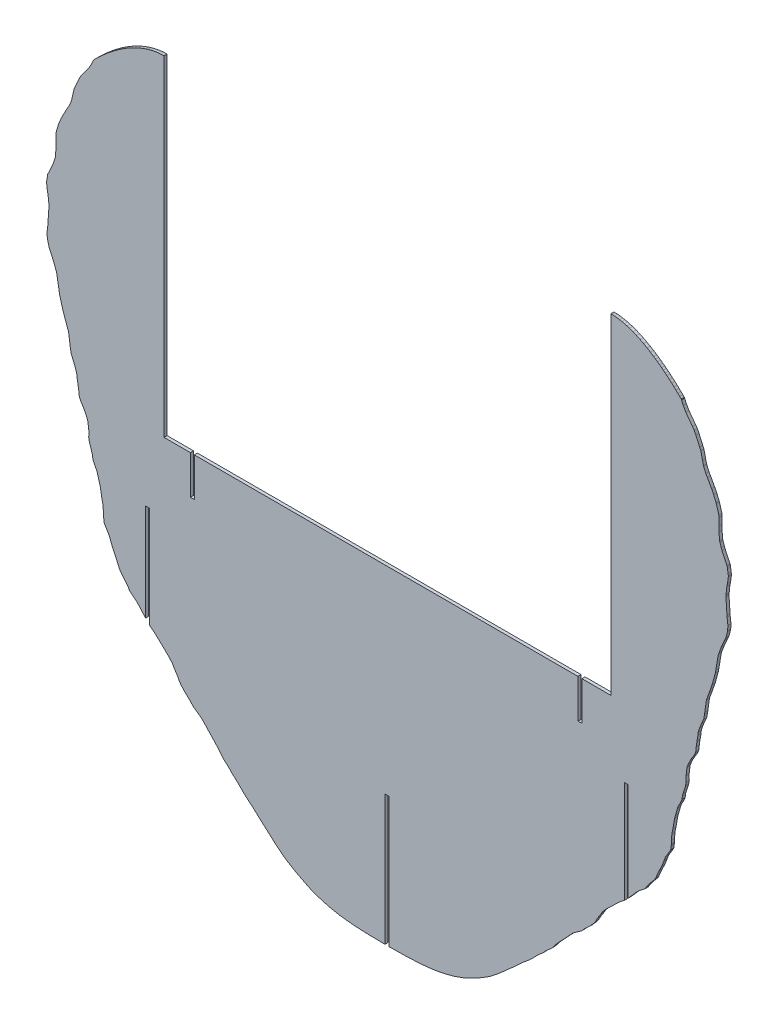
SolidWorks part; units mm, degrees
ref_plane "Спереди" through (0, 0, 0) normal (0, 0, 1) x (1, 0, 0)
ref_plane "Сверху" through (0, 0, 0) normal (0, 1, 0) x (1, 0, 0)
ref_plane "Справа" through (0, 0, 0) normal (1, 0, 0) x (0, 0, -1)
sketch "Model" plane through (0, 0, 0) normal (0, 0, 1) x (1, 0, 0)
  line L0 (-7682.8067, 1816.6971) -> (-7684.8067, 1816.6971)
  line L1 (-7684.8067, 1816.6971) -> (-7685.0567, 1816.6971)
  line L2 (-7685.0567, 1816.6971) -> (-7685.0567, 1732.4192)
  line L3 (-7685.0567, 1732.4192) -> (-7694.5872, 1732.5452)
  line L4 (-7694.5872, 1732.5452) -> (-7695.922, 1732.563)
  line L5 (-7695.922, 1732.563) -> (-7696.6975, 1732.6032)
  line L6 (-7696.6975, 1732.6032) -> (-7698.3765, 1732.6876)
  line L7 (-7698.3765, 1732.6876) -> (-7705.6061, 1733.0389)
  line L8 (-7705.6061, 1733.0389) -> (-7709.5556, 1733.4832)
  line L9 (-7709.5556, 1733.4832) -> (-7714.152, 1734.023)
  line L10 (-7714.152, 1734.023) -> (-7718.3061, 1734.8094)
  line L11 (-7718.3061, 1734.8094) -> (-7721.3007, 1735.4051)
  line L12 (-7721.3007, 1735.4051) -> (-7723.5175, 1736.0273)
  line L13 (-7723.5175, 1736.0273) -> (-7726.4439, 1736.831)
  line L14 (-7726.4439, 1736.831) -> (-7730.4207, 1738.2057)
  line L15 (-7730.4207, 1738.2057) -> (-7733.3113, 1739.2805)
  line L16 (-7733.3113, 1739.2805) -> (-7735.5196, 1740.3507)
  line L17 (-7735.5196, 1740.3507) -> (-7743.1818, 1744.2907)
  line L18 (-7743.1818, 1744.2907) -> (-7743.234, 1744.3141)
  line L19 (-7743.234, 1744.3141) -> (-7743.2862, 1744.3375)
  line L20 (-7743.2862, 1744.3375) -> (-7743.8617, 1744.6887)
  line L21 (-7743.8617, 1744.6887) -> (-7743.9294, 1744.7294)
  line L22 (-7743.9294, 1744.7294) -> (-7743.997, 1744.7701)
  line L23 (-7743.997, 1744.7701) -> (-7746.4079, 1746.2427)
  line L24 (-7746.4079, 1746.2427) -> (-7746.9716, 1746.5727)
  line L25 (-7746.9716, 1746.5727) -> (-7747.2628, 1746.7644)
  line L26 (-7747.2628, 1746.7644) -> (-7748.5724, 1747.5636)
  line L27 (-7748.5724, 1747.5636) -> (-7750.2895, 1748.7556)
  line L28 (-7750.2895, 1748.7556) -> (-7750.4549, 1748.8644)
  line L29 (-7750.4549, 1748.8644) -> (-7750.6203, 1748.9732)
  line L30 (-7750.6203, 1748.9732) -> (-7750.7251, 1749.0581)
  line L31 (-7750.7251, 1749.0581) -> (-7750.9248, 1749.1966)
  line L32 (-7750.9248, 1749.1966) -> (-7752.0277, 1750.1115)
  line L33 (-7752.0277, 1750.1115) -> (-7754.1352, 1751.8159)
  line L34 (-7754.1352, 1751.8159) -> (-7756.559, 1753.7467)
  line L35 (-7756.559, 1753.7467) -> (-7757.454, 1754.6197)
  line L36 (-7757.454, 1754.6197) -> (-7758.2773, 1755.2931)
  line L37 (-7758.2773, 1755.2931) -> (-7759.5082, 1756.4509)
  line L38 (-7759.5082, 1756.4509) -> (-7764.286, 1760.6263)
  line L39 (-7764.286, 1760.6263) -> (-7767.697, 1763.7832)
  line L40 (-7767.697, 1763.7832) -> (-7769.7344, 1765.6174)
  line L41 (-7769.7344, 1765.6174) -> (-7770.6738, 1766.5109)
  line L42 (-7770.6738, 1766.5109) -> (-7770.8443, 1766.6855)
  line L43 (-7770.8443, 1766.6855) -> (-7771.2598, 1767.0364)
  line L44 (-7771.2598, 1767.0364) -> (-7771.6414, 1767.3061)
  line L45 (-7771.6414, 1767.3061) -> (-7772.7886, 1768.2678)
  line L46 (-7772.7886, 1768.2678) -> (-7774.9976, 1770.1285)
  line L47 (-7774.9976, 1770.1285) -> (-7777.4658, 1772.4707)
  line L48 (-7777.4658, 1772.4707) -> (-7780.2333, 1775.2889)
  line L49 (-7780.2333, 1775.2889) -> (-7782.2505, 1777.1364)
  line L50 (-7782.2505, 1777.1364) -> (-7784.5093, 1779.1408)
  line L51 (-7784.5093, 1779.1408) -> (-7785.5694, 1780.417)
  line L52 (-7785.5694, 1780.417) -> (-7786.5279, 1781.2931)
  line L53 (-7786.5279, 1781.2931) -> (-7790.0308, 1784.4159)
  line L54 (-7790.0308, 1784.4159) -> (-7792.7157, 1787.8803)
  line L55 (-7792.7157, 1787.8803) -> (-7793.3302, 1788.6343)
  line L56 (-7793.3302, 1788.6343) -> (-7802.8222, 1798.7827)
  line L57 (-7802.8222, 1798.7827) -> (-7803.1732, 1799.1838)
  line L58 (-7803.1732, 1799.1838) -> (-7803.3726, 1799.3677)
  line L59 (-7803.3726, 1799.3677) -> (-7803.4627, 1799.4482)
  line L60 (-7803.4627, 1799.4482) -> (-7803.5528, 1799.5288)
  line L61 (-7803.5528, 1799.5288) -> (-7805.7115, 1801.1681)
  line L62 (-7805.7115, 1801.1681) -> (-7809.1877, 1803.6167)
  line L63 (-7809.1877, 1803.6167) -> (-7811.2248, 1805.8476)
  line L64 (-7811.2248, 1805.8476) -> (-7812.4073, 1807.0679)
  line L65 (-7812.4073, 1807.0679) -> (-7814.2071, 1808.6109)
  line L66 (-7814.2071, 1808.6109) -> (-7815.3023, 1809.8995)
  line L67 (-7815.3023, 1809.8995) -> (-7816.1569, 1810.8578)
  line L68 (-7816.1569, 1810.8578) -> (-7816.8136, 1811.4696)
  line L69 (-7816.8136, 1811.4696) -> (-7817.0815, 1811.8237)
  line L70 (-7817.0815, 1811.8237) -> (-7817.8921, 1812.8676)
  line L71 (-7817.8921, 1812.8676) -> (-7819.7722, 1816.3454)
  line L72 (-7819.7722, 1816.3454) -> (-7821.8108, 1819.4222)
  line L73 (-7821.8108, 1819.4222) -> (-7822.5205, 1820.7525)
  line L74 (-7822.5205, 1820.7525) -> (-7822.7491, 1821.1699)
  line L75 (-7822.7491, 1821.1699) -> (-7823.9225, 1822.4968)
  line L76 (-7823.9225, 1822.4968) -> (-7825.4693, 1824.1847)
  line L77 (-7825.4693, 1824.1847) -> (-7825.544, 1824.2576)
  line L78 (-7825.544, 1824.2576) -> (-7825.6187, 1824.3305)
  line L79 (-7825.6187, 1824.3305) -> (-7831.6382, 1830.1117)
  line L80 (-7831.6382, 1830.1117) -> (-7834.2581, 1832.5858)
  line L81 (-7834.2581, 1832.5858) -> (-7834.9102, 1833.0965)
  line L82 (-7834.9102, 1833.0965) -> (-7837.0452, 1834.675)
  line L83 (-7837.0452, 1834.675) -> (-7837.5566, 1835.1293)
  line L84 (-7837.5566, 1835.1293) -> (-7837.5566, 1900.7264)
  line L85 (-7837.5566, 1900.7264) -> (-7837.8067, 1900.7264)
  line L86 (-7837.8067, 1900.7264) -> (-7839.8067, 1900.7264)
  line L87 (-7839.8067, 1900.7264) -> (-7840.0566, 1900.7264)
  line L88 (-7840.0566, 1900.7264) -> (-7840.0566, 1837.8313)
  line L89 (-7840.0566, 1837.8313) -> (-7843.3888, 1841.5625)
  line L90 (-7843.3888, 1841.5625) -> (-7845.2083, 1843.6672)
  line L91 (-7845.2083, 1843.6672) -> (-7846.4612, 1844.7876)
  line L92 (-7846.4612, 1844.7876) -> (-7850.3521, 1847.8705)
  line L93 (-7850.3521, 1847.8705) -> (-7850.5937, 1848.3136)
  line L94 (-7850.5937, 1848.3136) -> (-7851.1968, 1849.394)
  line L95 (-7851.1968, 1849.394) -> (-7853.201, 1851.9539)
  line L96 (-7853.201, 1851.9539) -> (-7853.3551, 1852.2241)
  line L97 (-7853.3551, 1852.2241) -> (-7853.5092, 1852.4941)
  line L98 (-7853.5092, 1852.4941) -> (-7854.2362, 1853.3435)
  line L99 (-7854.2362, 1853.3435) -> (-7856.4761, 1855.9941)
  line L100 (-7856.4761, 1855.9941) -> (-7857.1615, 1857.2459)
  line L101 (-7857.1615, 1857.2459) -> (-7859.3013, 1862.3312)
  line L102 (-7859.3013, 1862.3312) -> (-7859.4154, 1862.5205)
  line L103 (-7859.4154, 1862.5205) -> (-7859.5295, 1862.7099)
  line L104 (-7859.5295, 1862.7099) -> (-7861.0658, 1865.8437)
  line L105 (-7861.0658, 1865.8437) -> (-7862.3867, 1869.1102)
  line L106 (-7862.3867, 1869.1102) -> (-7862.7143, 1870.1605)
  line L107 (-7862.7143, 1870.1605) -> (-7863.5424, 1872.2092)
  line L108 (-7863.5424, 1872.2092) -> (-7864.0264, 1873.0658)
  line L109 (-7864.0264, 1873.0658) -> (-7865.7778, 1876.0008)
  line L110 (-7865.7778, 1876.0008) -> (-7866.633, 1877.4193)
  line L111 (-7866.633, 1877.4193) -> (-7866.8648, 1877.8224)
  line L112 (-7866.8648, 1877.8224) -> (-7866.8966, 1878.0422)
  line L113 (-7866.8966, 1878.0422) -> (-7867.1363, 1879.9429)
  line L114 (-7867.1363, 1879.9429) -> (-7867.149, 1880.0046)
  line L115 (-7867.149, 1880.0046) -> (-7867.1616, 1880.0663)
  line L116 (-7867.1616, 1880.0663) -> (-7867.2687, 1880.8363)
  line L117 (-7867.2687, 1880.8363) -> (-7867.2692, 1880.8931)
  line L118 (-7867.2692, 1880.8931) -> (-7867.2697, 1880.9499)
  line L119 (-7867.2697, 1880.9499) -> (-7867.3443, 1881.3376)
  line L120 (-7867.3443, 1881.3376) -> (-7867.4187, 1881.7254)
  line L121 (-7867.4187, 1881.7254) -> (-7867.4087, 1883.4935)
  line L122 (-7867.4087, 1883.4935) -> (-7867.6081, 1887.1702)
  line L123 (-7867.6081, 1887.1702) -> (-7868.324, 1890.5357)
  line L124 (-7868.324, 1890.5357) -> (-7869.4164, 1896.8975)
  line L125 (-7869.4164, 1896.8975) -> (-7869.9439, 1898.7127)
  line L126 (-7869.9439, 1898.7127) -> (-7871.2528, 1903.4152)
  line L127 (-7871.2528, 1903.4152) -> (-7871.6748, 1904.7111)
  line L128 (-7871.6748, 1904.7111) -> (-7872.5829, 1906.3719)
  line L129 (-7872.5829, 1906.3719) -> (-7873.5435, 1908.2987)
  line L130 (-7873.5435, 1908.2987) -> (-7874.2554, 1909.9143)
  line L131 (-7874.2554, 1909.9143) -> (-7874.3811, 1911.7143)
  line L132 (-7874.3811, 1911.7143) -> (-7874.9241, 1913.5987)
  line L133 (-7874.9241, 1913.5987) -> (-7876.4357, 1918.3222)
  line L134 (-7876.4357, 1918.3222) -> (-7876.5075, 1918.7488)
  line L135 (-7876.5075, 1918.7488) -> (-7876.8971, 1920.8739)
  line L136 (-7876.8971, 1920.8739) -> (-7876.8352, 1924.3529)
  line L137 (-7876.8352, 1924.3529) -> (-7876.8524, 1924.7933)
  line L138 (-7876.8524, 1924.7933) -> (-7877.4145, 1929.2624)
  line L139 (-7877.4145, 1929.2624) -> (-7877.5814, 1929.9736)
  line L140 (-7877.5814, 1929.9736) -> (-7878.2528, 1931.6759)
  line L141 (-7878.2528, 1931.6759) -> (-7879.4857, 1934.2783)
  line L142 (-7879.4857, 1934.2783) -> (-7880.6743, 1936.3831)
  line L143 (-7880.6743, 1936.3831) -> (-7882.069, 1938.5015)
  line L144 (-7882.069, 1938.5015) -> (-7882.7613, 1940.0566)
  line L145 (-7882.7613, 1940.0566) -> (-7883.0806, 1941.0658)
  line L146 (-7883.0806, 1941.0658) -> (-7883.3842, 1943.9815)
  line L147 (-7883.3842, 1943.9815) -> (-7883.8758, 1947.2676)
  line L148 (-7883.8758, 1947.2676) -> (-7883.8871, 1947.3369)
  line L149 (-7883.8871, 1947.3369) -> (-7883.8983, 1947.4062)
  line L150 (-7883.8983, 1947.4062) -> (-7884.5602, 1951.0952)
  line L151 (-7884.5602, 1951.0952) -> (-7884.661, 1952.5154)
  line L152 (-7884.661, 1952.5154) -> (-7884.6936, 1952.7341)
  line L153 (-7884.6936, 1952.7341) -> (-7885.6231, 1955.6312)
  line L154 (-7885.6231, 1955.6312) -> (-7886.7302, 1958.5313)
  line L155 (-7886.7302, 1958.5313) -> (-7888.2287, 1961.8506)
  line L156 (-7888.2287, 1961.8506) -> (-7888.786, 1964.8717)
  line L157 (-7888.786, 1964.8717) -> (-7888.8556, 1965.4174)
  line L158 (-7888.8556, 1965.4174) -> (-7888.9253, 1965.963)
  line L159 (-7888.9253, 1965.963) -> (-7889.9683, 1973.4234)
  line L160 (-7889.9683, 1973.4234) -> (-7891.7676, 1978.4349)
  line L161 (-7891.7676, 1978.4349) -> (-7893.6808, 1983.8616)
  line L162 (-7893.6808, 1983.8616) -> (-7895.7473, 1991.3936)
  line L163 (-7895.7473, 1991.3936) -> (-7895.7672, 1991.4961)
  line L164 (-7895.7672, 1991.4961) -> (-7895.7871, 1991.5986)
  line L165 (-7895.7871, 1991.5986) -> (-7896.0503, 1993.1978)
  line L166 (-7896.0503, 1993.1978) -> (-7897.7259, 2003.0528)
  line L167 (-7897.7259, 2003.0528) -> (-7898.364, 2004.5166)
  line L168 (-7898.364, 2004.5166) -> (-7899.5729, 2007.9406)
  line L169 (-7899.5729, 2007.9406) -> (-7901.8242, 2012.8467)
  line L170 (-7901.8242, 2012.8467) -> (-7902.437, 2014.1933)
  line L171 (-7902.437, 2014.1933) -> (-7902.651, 2014.8167)
  line L172 (-7902.651, 2014.8167) -> (-7903.6461, 2018.7478)
  line L173 (-7903.6461, 2018.7478) -> (-7903.6918, 2019.119)
  line L174 (-7903.6918, 2019.119) -> (-7903.7376, 2019.4904)
  line L175 (-7903.7376, 2019.4904) -> (-7903.9089, 2022.2407)
  line L176 (-7903.9089, 2022.2407) -> (-7903.3826, 2026.507)
  line L177 (-7903.3826, 2026.507) -> (-7903.3112, 2027.6613)
  line L178 (-7903.3112, 2027.6613) -> (-7902.6491, 2037.4619)
  line L179 (-7902.6491, 2037.4619) -> (-7902.5996, 2038.0979)
  line L180 (-7902.5996, 2038.0979) -> (-7902.6064, 2038.2303)
  line L181 (-7902.6064, 2038.2303) -> (-7902.6131, 2038.3627)
  line L182 (-7902.6131, 2038.3627) -> (-7902.7473, 2039.1633)
  line L183 (-7902.7473, 2039.1633) -> (-7903.2405, 2043.7789)
  line L184 (-7903.2405, 2043.7789) -> (-7903.6573, 2045.608)
  line L185 (-7903.6573, 2045.608) -> (-7904.1864, 2049.674)
  line L186 (-7904.1864, 2049.674) -> (-7904.2077, 2049.8358)
  line L187 (-7904.2077, 2049.8358) -> (-7904.229, 2049.9976)
  line L188 (-7904.229, 2049.9976) -> (-7904.2272, 2050.1142)
  line L189 (-7904.2272, 2050.1142) -> (-7904.2173, 2050.2257)
  line L190 (-7904.2173, 2050.2257) -> (-7904.2074, 2050.3372)
  line L191 (-7904.2074, 2050.3372) -> (-7904.0686, 2051.2373)
  line L192 (-7904.0686, 2051.2373) -> (-7903.647, 2053.9626)
  line L193 (-7903.647, 2053.9626) -> (-7903.4793, 2054.9942)
  line L194 (-7903.4793, 2054.9942) -> (-7903.4503, 2055.0794)
  line L195 (-7903.4503, 2055.0794) -> (-7903.4215, 2055.1646)
  line L196 (-7903.4215, 2055.1646) -> (-7903.3057, 2055.4107)
  line L197 (-7903.3057, 2055.4107) -> (-7903.19, 2055.6567)
  line L198 (-7903.19, 2055.6567) -> (-7900.1289, 2062.3024)
  line L199 (-7900.1289, 2062.3024) -> (-7899.6081, 2063.6768)
  line L200 (-7899.6081, 2063.6768) -> (-7898.7962, 2066.1643)
  line L201 (-7898.7962, 2066.1643) -> (-7898.6095, 2066.6459)
  line L202 (-7898.6095, 2066.6459) -> (-7898.5087, 2067.1734)
  line L203 (-7898.5087, 2067.1734) -> (-7898.1421, 2071.8947)
  line L204 (-7898.1421, 2071.8947) -> (-7898.0988, 2075.0473)
  line L205 (-7898.0988, 2075.0473) -> (-7898.1437, 2079.9737)
  line L206 (-7898.1437, 2079.9737) -> (-7898.054, 2081.1626)
  line L207 (-7898.054, 2081.1626) -> (-7896.399, 2086.8983)
  line L208 (-7896.399, 2086.8983) -> (-7896.3144, 2087.0912)
  line L209 (-7896.3144, 2087.0912) -> (-7896.2298, 2087.2842)
  line L210 (-7896.2298, 2087.2842) -> (-7894.642, 2091.0169)
  line L211 (-7894.642, 2091.0169) -> (-7893.3412, 2093.6799)
  line L212 (-7893.3412, 2093.6799) -> (-7890.6491, 2098.5994)
  line L213 (-7890.6491, 2098.5994) -> (-7889.605, 2100.3488)
  line L214 (-7889.605, 2100.3488) -> (-7888.2179, 2103.6898)
  line L215 (-7888.2179, 2103.6898) -> (-7888.0739, 2104.0065)
  line L216 (-7888.0739, 2104.0065) -> (-7887.4706, 2106.6902)
  line L217 (-7887.4706, 2106.6902) -> (-7886.3467, 2111.6159)
  line L218 (-7886.3467, 2111.6159) -> (-7885.6828, 2113.0454)
  line L219 (-7885.6828, 2113.0454) -> (-7883.1785, 2118.6527)
  line L220 (-7883.1785, 2118.6527) -> (-7882.0835, 2120.8909)
  line L221 (-7882.0835, 2120.8909) -> (-7880.9262, 2122.5022)
  line L222 (-7880.9262, 2122.5022) -> (-7876.7884, 2128.0555)
  line L223 (-7876.7884, 2128.0555) -> (-7874.9889, 2131.2631)
  line L224 (-7874.9889, 2131.2631) -> (-7873.9246, 2133.5749)
  line L225 (-7873.9246, 2133.5749) -> (-7873.8578, 2133.6571)
  line L226 (-7873.8578, 2133.6571) -> (-7873.6701, 2134.1511)
  line L227 (-7873.6701, 2134.1511) -> (-7872.6506, 2135.1615)
  line L228 (-7872.6506, 2135.1615) -> (-7871.5229, 2136.2575)
  line L229 (-7871.5229, 2136.2575) -> (-7870.2915, 2137.4275)
  line L230 (-7870.2915, 2137.4275) -> (-7868.961, 2138.6606)
  line L231 (-7868.961, 2138.6606) -> (-7867.5361, 2139.9453)
  line L232 (-7867.5361, 2139.9453) -> (-7866.0212, 2141.2705)
  line L233 (-7866.0212, 2141.2705) -> (-7864.4209, 2142.6246)
  line L234 (-7864.4209, 2142.6246) -> (-7863.2887, 2143.5545)
  line L235 (-7863.2887, 2143.5545) -> (-7862.1206, 2144.489)
  line L236 (-7862.1206, 2144.489) -> (-7860.9182, 2145.4246)
  line L237 (-7860.9182, 2145.4246) -> (-7859.6829, 2146.3579)
  line L238 (-7859.6829, 2146.3579) -> (-7858.416, 2147.2851)
  line L239 (-7858.416, 2147.2851) -> (-7857.1192, 2148.2031)
  line L240 (-7857.1192, 2148.2031) -> (-7855.7937, 2149.108)
  line L241 (-7855.7937, 2149.108) -> (-7853.702, 2150.4668)
  line L242 (-7853.702, 2150.4668) -> (-7851.5512, 2151.7736)
  line L243 (-7851.5512, 2151.7736) -> (-7849.3463, 2153.0155)
  line L244 (-7849.3463, 2153.0155) -> (-7847.0928, 2154.18)
  line L245 (-7847.0928, 2154.18) -> (-7844.7957, 2155.2541)
  line L246 (-7844.7957, 2155.2541) -> (-7842.4602, 2156.225)
  line L247 (-7842.4602, 2156.225) -> (-7840.0916, 2157.0797)
  line L248 (-7840.0916, 2157.0797) -> (-7838.5056, 2157.5761)
  line L249 (-7838.5056, 2157.5761) -> (-7836.9084, 2158.0124)
  line L250 (-7836.9084, 2158.0124) -> (-7835.3014, 2158.3846)
  line L251 (-7835.3014, 2158.3846) -> (-7833.6867, 2158.6889)
  line L252 (-7833.6867, 2158.6889) -> (-7832.0659, 2158.9216)
  line L253 (-7832.0659, 2158.9216) -> (-7830.4407, 2159.0789)
  line L254 (-7830.4407, 2159.0789) -> (-7828.8128, 2159.1568)
  line L255 (-7828.8128, 2159.1568) -> (-7828.0956, 2159.1632)
  line L256 (-7828.0956, 2159.1632) -> (-7828.0956, 1945.1723)
  line L257 (-7828.0956, 1945.1723) -> (-7811.0567, 1945.1723)
  line L258 (-7811.0567, 1945.1723) -> (-7811.0567, 1920.115)
  line L259 (-7811.0567, 1920.115) -> (-7810.8067, 1920.115)
  line L260 (-7810.8067, 1920.115) -> (-7808.8067, 1920.115)
  line L261 (-7808.8067, 1920.115) -> (-7808.5567, 1920.115)
  line L262 (-7808.5567, 1920.115) -> (-7808.5567, 1945.1723)
  line L263 (-7808.5567, 1945.1723) -> (-7560.0568, 1945.1723)
  line L264 (-7560.0568, 1945.1723) -> (-7560.0568, 1920.115)
  line L265 (-7560.0568, 1920.115) -> (-7559.8067, 1920.115)
  line L266 (-7559.8067, 1920.115) -> (-7557.8067, 1920.115)
  line L267 (-7557.8067, 1920.115) -> (-7557.5568, 1920.115)
  line L268 (-7557.5568, 1920.115) -> (-7557.5568, 1945.1723)
  line L269 (-7557.5568, 1945.1723) -> (-7538.8067, 1945.1723)
  line L270 (-7538.8067, 1945.1723) -> (-7538.8067, 2159.1632)
  line L271 (-7538.8067, 2159.1632) -> (-7538.4496, 2159.16)
  line L272 (-7538.4496, 2159.16) -> (-7538.0925, 2159.1568)
  line L273 (-7538.0925, 2159.1568) -> (-7536.4644, 2159.079)
  line L274 (-7536.4644, 2159.079) -> (-7534.8387, 2158.9218)
  line L275 (-7534.8387, 2158.9218) -> (-7533.2173, 2158.689)
  line L276 (-7533.2173, 2158.689) -> (-7531.602, 2158.3845)
  line L277 (-7531.602, 2158.3845) -> (-7529.9945, 2158.0123)
  line L278 (-7529.9945, 2158.0123) -> (-7528.3967, 2157.5761)
  line L279 (-7528.3967, 2157.5761) -> (-7526.8106, 2157.0797)
  line L280 (-7526.8106, 2157.0797) -> (-7524.442, 2156.2251)
  line L281 (-7524.442, 2156.2251) -> (-7522.1064, 2155.2542)
  line L282 (-7522.1064, 2155.2542) -> (-7519.8094, 2154.18)
  line L283 (-7519.8094, 2154.18) -> (-7517.5558, 2153.0155)
  line L284 (-7517.5558, 2153.0155) -> (-7515.3511, 2151.7734)
  line L285 (-7515.3511, 2151.7734) -> (-7513.2002, 2150.4667)
  line L286 (-7513.2002, 2150.4667) -> (-7511.1086, 2149.108)
  line L287 (-7511.1086, 2149.108) -> (-7509.783, 2148.2031)
  line L288 (-7509.783, 2148.2031) -> (-7508.4861, 2147.2852)
  line L289 (-7508.4861, 2147.2852) -> (-7507.2193, 2146.3578)
  line L290 (-7507.2193, 2146.3578) -> (-7505.984, 2145.4246)
  line L291 (-7505.984, 2145.4246) -> (-7504.7816, 2144.4889)
  line L292 (-7504.7816, 2144.4889) -> (-7503.6136, 2143.5545)
  line L293 (-7503.6136, 2143.5545) -> (-7502.4813, 2142.6246)
  line L294 (-7502.4813, 2142.6246) -> (-7500.8809, 2141.2706)
  line L295 (-7500.8809, 2141.2706) -> (-7499.3661, 2139.9453)
  line L296 (-7499.3661, 2139.9453) -> (-7497.9412, 2138.6606)
  line L297 (-7497.9412, 2138.6606) -> (-7496.6107, 2137.4275)
  line L298 (-7496.6107, 2137.4275) -> (-7495.3794, 2136.2573)
  line L299 (-7495.3794, 2136.2573) -> (-7494.2516, 2135.1615)
  line L300 (-7494.2516, 2135.1615) -> (-7493.2321, 2134.1511)
  line L301 (-7493.2321, 2134.1511) -> (-7493.0444, 2133.6571)
  line L302 (-7493.0444, 2133.6571) -> (-7492.9777, 2133.5749)
  line L303 (-7492.9777, 2133.5749) -> (-7491.9133, 2131.2631)
  line L304 (-7491.9133, 2131.2631) -> (-7490.1139, 2128.0555)
  line L305 (-7490.1139, 2128.0555) -> (-7485.9761, 2122.5022)
  line L306 (-7485.9761, 2122.5022) -> (-7484.8188, 2120.8909)
  line L307 (-7484.8188, 2120.8909) -> (-7483.7238, 2118.6527)
  line L308 (-7483.7238, 2118.6527) -> (-7481.2195, 2113.0454)
  line L309 (-7481.2195, 2113.0454) -> (-7480.5555, 2111.6159)
  line L310 (-7480.5555, 2111.6159) -> (-7479.4315, 2106.6902)
  line L311 (-7479.4315, 2106.6902) -> (-7478.8284, 2104.0065)
  line L312 (-7478.8284, 2104.0065) -> (-7478.6843, 2103.6898)
  line L313 (-7478.6843, 2103.6898) -> (-7477.2972, 2100.3488)
  line L314 (-7477.2972, 2100.3488) -> (-7476.2531, 2098.5994)
  line L315 (-7476.2531, 2098.5994) -> (-7473.561, 2093.6799)
  line L316 (-7473.561, 2093.6799) -> (-7472.2602, 2091.0169)
  line L317 (-7472.2602, 2091.0169) -> (-7470.6724, 2087.2842)
  line L318 (-7470.6724, 2087.2842) -> (-7470.5879, 2087.0912)
  line L319 (-7470.5879, 2087.0912) -> (-7470.5033, 2086.8983)
  line L320 (-7470.5033, 2086.8983) -> (-7468.8483, 2081.1626)
  line L321 (-7468.8483, 2081.1626) -> (-7468.7585, 2079.9737)
  line L322 (-7468.7585, 2079.9737) -> (-7468.8035, 2075.0473)
  line L323 (-7468.8035, 2075.0473) -> (-7468.7601, 2071.8947)
  line L324 (-7468.7601, 2071.8947) -> (-7468.3935, 2067.1734)
  line L325 (-7468.3935, 2067.1734) -> (-7468.2927, 2066.6459)
  line L326 (-7468.2927, 2066.6459) -> (-7468.106, 2066.1643)
  line L327 (-7468.106, 2066.1643) -> (-7467.2942, 2063.6768)
  line L328 (-7467.2942, 2063.6768) -> (-7466.7732, 2062.3024)
  line L329 (-7466.7732, 2062.3024) -> (-7463.7123, 2055.6567)
  line L330 (-7463.7123, 2055.6567) -> (-7463.4807, 2055.1646)
  line L331 (-7463.4807, 2055.1646) -> (-7463.423, 2054.9942)
  line L332 (-7463.423, 2054.9942) -> (-7463.2552, 2053.9626)
  line L333 (-7463.2552, 2053.9626) -> (-7462.8336, 2051.2373)
  line L334 (-7462.8336, 2051.2373) -> (-7462.6983, 2050.3742)
  line L335 (-7462.6983, 2050.3742) -> (-7462.6751, 2050.1142)
  line L336 (-7462.6751, 2050.1142) -> (-7462.6732, 2050.0025)
  line L337 (-7462.6732, 2050.0025) -> (-7462.7158, 2049.674)
  line L338 (-7462.7158, 2049.674) -> (-7463.245, 2045.608)
  line L339 (-7463.245, 2045.608) -> (-7463.6618, 2043.7789)
  line L340 (-7463.6618, 2043.7789) -> (-7464.155, 2039.1633)
  line L341 (-7464.155, 2039.1633) -> (-7464.2891, 2038.3627)
  line L342 (-7464.2891, 2038.3627) -> (-7464.3026, 2038.0979)
  line L343 (-7464.3026, 2038.0979) -> (-7464.2531, 2037.4619)
  line L344 (-7464.2531, 2037.4619) -> (-7463.591, 2027.6613)
  line L345 (-7463.591, 2027.6613) -> (-7463.5197, 2026.507)
  line L346 (-7463.5197, 2026.507) -> (-7462.9933, 2022.2407)
  line L347 (-7462.9933, 2022.2407) -> (-7463.1647, 2019.4904)
  line L348 (-7463.1647, 2019.4904) -> (-7463.2561, 2018.7478)
  line L349 (-7463.2561, 2018.7478) -> (-7464.2512, 2014.8167)
  line L350 (-7464.2512, 2014.8167) -> (-7464.4652, 2014.1933)
  line L351 (-7464.4652, 2014.1933) -> (-7465.078, 2012.8467)
  line L352 (-7465.078, 2012.8467) -> (-7467.3293, 2007.9406)
  line L353 (-7467.3293, 2007.9406) -> (-7468.5382, 2004.5166)
  line L354 (-7468.5382, 2004.5166) -> (-7469.1764, 2003.0528)
  line L355 (-7469.1764, 2003.0528) -> (-7470.852, 1993.1978)
  line L356 (-7470.852, 1993.1978) -> (-7471.1151, 1991.5986)
  line L357 (-7471.1151, 1991.5986) -> (-7471.1549, 1991.3936)
  line L358 (-7471.1549, 1991.3936) -> (-7473.2214, 1983.8616)
  line L359 (-7473.2214, 1983.8616) -> (-7475.1347, 1978.4349)
  line L360 (-7475.1347, 1978.4349) -> (-7476.9339, 1973.4234)
  line L361 (-7476.9339, 1973.4234) -> (-7477.9769, 1965.963)
  line L362 (-7477.9769, 1965.963) -> (-7478.1162, 1964.8717)
  line L363 (-7478.1162, 1964.8717) -> (-7478.6736, 1961.8506)
  line L364 (-7478.6736, 1961.8506) -> (-7480.172, 1958.5313)
  line L365 (-7480.172, 1958.5313) -> (-7481.2791, 1955.6312)
  line L366 (-7481.2791, 1955.6312) -> (-7482.2072, 1952.7402)
  line L367 (-7482.2072, 1952.7402) -> (-7482.2412, 1952.5154)
  line L368 (-7482.2412, 1952.5154) -> (-7482.3421, 1951.0952)
  line L369 (-7482.3421, 1951.0952) -> (-7483.0039, 1947.4062)
  line L370 (-7483.0039, 1947.4062) -> (-7483.0264, 1947.2676)
  line L371 (-7483.0264, 1947.2676) -> (-7483.5181, 1943.9815)
  line L372 (-7483.5181, 1943.9815) -> (-7483.8216, 1941.0658)
  line L373 (-7483.8216, 1941.0658) -> (-7484.141, 1940.0566)
  line L374 (-7484.141, 1940.0566) -> (-7484.8333, 1938.5015)
  line L375 (-7484.8333, 1938.5015) -> (-7486.2279, 1936.3831)
  line L376 (-7486.2279, 1936.3831) -> (-7487.4165, 1934.2783)
  line L377 (-7487.4165, 1934.2783) -> (-7488.6493, 1931.6759)
  line L378 (-7488.6493, 1931.6759) -> (-7489.3208, 1929.9736)
  line L379 (-7489.3208, 1929.9736) -> (-7489.4878, 1929.2624)
  line L380 (-7489.4878, 1929.2624) -> (-7490.0498, 1924.7933)
  line L381 (-7490.0498, 1924.7933) -> (-7490.067, 1924.3529)
  line L382 (-7490.067, 1924.3529) -> (-7490.0052, 1920.8739)
  line L383 (-7490.0052, 1920.8739) -> (-7490.3947, 1918.7488)
  line L384 (-7490.3947, 1918.7488) -> (-7490.4665, 1918.3222)
  line L385 (-7490.4665, 1918.3222) -> (-7491.9782, 1913.5987)
  line L386 (-7491.9782, 1913.5987) -> (-7492.5211, 1911.7143)
  line L387 (-7492.5211, 1911.7143) -> (-7492.6469, 1909.9143)
  line L388 (-7492.6469, 1909.9143) -> (-7493.3587, 1908.2987)
  line L389 (-7493.3587, 1908.2987) -> (-7494.3193, 1906.3719)
  line L390 (-7494.3193, 1906.3719) -> (-7495.2274, 1904.7111)
  line L391 (-7495.2274, 1904.7111) -> (-7495.6494, 1903.4152)
  line L392 (-7495.6494, 1903.4152) -> (-7496.9583, 1898.7127)
  line L393 (-7496.9583, 1898.7127) -> (-7497.4859, 1896.8975)
  line L394 (-7497.4859, 1896.8975) -> (-7498.5782, 1890.5357)
  line L395 (-7498.5782, 1890.5357) -> (-7499.2942, 1887.1702)
  line L396 (-7499.2942, 1887.1702) -> (-7499.4935, 1883.4935)
  line L397 (-7499.4935, 1883.4935) -> (-7499.4835, 1881.7254)
  line L398 (-7499.4835, 1881.7254) -> (-7499.6325, 1880.9499)
  line L399 (-7499.6325, 1880.9499) -> (-7499.6336, 1880.8363)
  line L400 (-7499.6336, 1880.8363) -> (-7499.7405, 1880.0663)
  line L401 (-7499.7405, 1880.0663) -> (-7499.766, 1879.9429)
  line L402 (-7499.766, 1879.9429) -> (-7500.0056, 1878.0422)
  line L403 (-7500.0056, 1878.0422) -> (-7500.0375, 1877.8224)
  line L404 (-7500.0375, 1877.8224) -> (-7500.2693, 1877.4193)
  line L405 (-7500.2693, 1877.4193) -> (-7501.1244, 1876.0008)
  line L406 (-7501.1244, 1876.0008) -> (-7502.8759, 1873.0658)
  line L407 (-7502.8759, 1873.0658) -> (-7503.3598, 1872.2092)
  line L408 (-7503.3598, 1872.2092) -> (-7504.188, 1870.1605)
  line L409 (-7504.188, 1870.1605) -> (-7504.5155, 1869.1102)
  line L410 (-7504.5155, 1869.1102) -> (-7505.8364, 1865.8437)
  line L411 (-7505.8364, 1865.8437) -> (-7507.3728, 1862.7099)
  line L412 (-7507.3728, 1862.7099) -> (-7507.6009, 1862.3312)
  line L413 (-7507.6009, 1862.3312) -> (-7509.7408, 1857.2459)
  line L414 (-7509.7408, 1857.2459) -> (-7510.4261, 1855.9941)
  line L415 (-7510.4261, 1855.9941) -> (-7512.6661, 1853.3435)
  line L416 (-7512.6661, 1853.3435) -> (-7513.393, 1852.4941)
  line L417 (-7513.393, 1852.4941) -> (-7513.7013, 1851.9539)
  line L418 (-7513.7013, 1851.9539) -> (-7515.7054, 1849.394)
  line L419 (-7515.7054, 1849.394) -> (-7516.3086, 1848.3136)
  line L420 (-7516.3086, 1848.3136) -> (-7516.5321, 1847.8927)
  line L421 (-7516.5321, 1847.8927) -> (-7520.441, 1844.7876)
  line L422 (-7520.441, 1844.7876) -> (-7521.694, 1843.6672)
  line L423 (-7521.694, 1843.6672) -> (-7523.5135, 1841.5625)
  line L424 (-7523.5135, 1841.5625) -> (-7527.5567, 1837.0351)
  line L425 (-7527.5567, 1837.0351) -> (-7527.5567, 1900.7264)
  line L426 (-7527.5567, 1900.7264) -> (-7527.8067, 1900.7264)
  line L427 (-7527.8067, 1900.7264) -> (-7529.8067, 1900.7264)
  line L428 (-7529.8067, 1900.7264) -> (-7530.0567, 1900.7264)
  line L429 (-7530.0567, 1900.7264) -> (-7530.0567, 1834.5274)
  line L430 (-7530.0567, 1834.5274) -> (-7531.992, 1833.0965)
  line L431 (-7531.992, 1833.0965) -> (-7532.6441, 1832.5858)
  line L432 (-7532.6441, 1832.5858) -> (-7535.264, 1830.1117)
  line L433 (-7535.264, 1830.1117) -> (-7541.2835, 1824.3305)
  line L434 (-7541.2835, 1824.3305) -> (-7541.3582, 1824.2576)
  line L435 (-7541.3582, 1824.2576) -> (-7541.433, 1824.1847)
  line L436 (-7541.433, 1824.1847) -> (-7542.9797, 1822.4968)
  line L437 (-7542.9797, 1822.4968) -> (-7544.1531, 1821.1699)
  line L438 (-7544.1531, 1821.1699) -> (-7544.3817, 1820.7525)
  line L439 (-7544.3817, 1820.7525) -> (-7545.0914, 1819.4222)
  line L440 (-7545.0914, 1819.4222) -> (-7547.13, 1816.3454)
  line L441 (-7547.13, 1816.3454) -> (-7549.0101, 1812.8676)
  line L442 (-7549.0101, 1812.8676) -> (-7549.8207, 1811.8237)
  line L443 (-7549.8207, 1811.8237) -> (-7550.0886, 1811.4696)
  line L444 (-7550.0886, 1811.4696) -> (-7550.7454, 1810.8578)
  line L445 (-7550.7454, 1810.8578) -> (-7551.5999, 1809.8995)
  line L446 (-7551.5999, 1809.8995) -> (-7552.6952, 1808.6109)
  line L447 (-7552.6952, 1808.6109) -> (-7554.495, 1807.0679)
  line L448 (-7554.495, 1807.0679) -> (-7555.6775, 1805.8476)
  line L449 (-7555.6775, 1805.8476) -> (-7557.7146, 1803.6167)
  line L450 (-7557.7146, 1803.6167) -> (-7561.1908, 1801.1681)
  line L451 (-7561.1908, 1801.1681) -> (-7563.3494, 1799.5288)
  line L452 (-7563.3494, 1799.5288) -> (-7563.4395, 1799.4482)
  line L453 (-7563.4395, 1799.4482) -> (-7563.5297, 1799.3677)
  line L454 (-7563.5297, 1799.3677) -> (-7563.729, 1799.1838)
  line L455 (-7563.729, 1799.1838) -> (-7564.08, 1798.7827)
  line L456 (-7564.08, 1798.7827) -> (-7573.572, 1788.6343)
  line L457 (-7573.572, 1788.6343) -> (-7574.1866, 1787.8803)
  line L458 (-7574.1866, 1787.8803) -> (-7576.8715, 1784.4159)
  line L459 (-7576.8715, 1784.4159) -> (-7580.3743, 1781.2931)
  line L460 (-7580.3743, 1781.2931) -> (-7581.3328, 1780.417)
  line L461 (-7581.3328, 1780.417) -> (-7582.3929, 1779.1408)
  line L462 (-7582.3929, 1779.1408) -> (-7584.6517, 1777.1364)
  line L463 (-7584.6517, 1777.1364) -> (-7586.6689, 1775.2889)
  line L464 (-7586.6689, 1775.2889) -> (-7589.4364, 1772.4707)
  line L465 (-7589.4364, 1772.4707) -> (-7591.9046, 1770.1285)
  line L466 (-7591.9046, 1770.1285) -> (-7594.1136, 1768.2678)
  line L467 (-7594.1136, 1768.2678) -> (-7595.2609, 1767.3061)
  line L468 (-7595.2609, 1767.3061) -> (-7595.4516, 1767.1713)
  line L469 (-7595.4516, 1767.1713) -> (-7595.6424, 1767.0364)
  line L470 (-7595.6424, 1767.0364) -> (-7596.0579, 1766.6855)
  line L471 (-7596.0579, 1766.6855) -> (-7596.2285, 1766.5109)
  line L472 (-7596.2285, 1766.5109) -> (-7597.1678, 1765.6174)
  line L473 (-7597.1678, 1765.6174) -> (-7599.2053, 1763.7832)
  line L474 (-7599.2053, 1763.7832) -> (-7602.6162, 1760.6263)
  line L475 (-7602.6162, 1760.6263) -> (-7607.394, 1756.4509)
  line L476 (-7607.394, 1756.4509) -> (-7608.625, 1755.2931)
  line L477 (-7608.625, 1755.2931) -> (-7609.4482, 1754.6197)
  line L478 (-7609.4482, 1754.6197) -> (-7610.3432, 1753.7467)
  line L479 (-7610.3432, 1753.7467) -> (-7612.7671, 1751.8159)
  line L480 (-7612.7671, 1751.8159) -> (-7614.8745, 1750.1115)
  line L481 (-7614.8745, 1750.1115) -> (-7615.9774, 1749.1966)
  line L482 (-7615.9774, 1749.1966) -> (-7616.1771, 1749.0581)
  line L483 (-7616.1771, 1749.0581) -> (-7616.2295, 1749.0156)
  line L484 (-7616.2295, 1749.0156) -> (-7616.282, 1748.9732)
  line L485 (-7616.282, 1748.9732) -> (-7616.4474, 1748.8644)
  line L486 (-7616.4474, 1748.8644) -> (-7616.6128, 1748.7556)
  line L487 (-7616.6128, 1748.7556) -> (-7618.3298, 1747.5636)
  line L488 (-7618.3298, 1747.5636) -> (-7619.6394, 1746.7644)
  line L489 (-7619.6394, 1746.7644) -> (-7619.785, 1746.6686)
  line L490 (-7619.785, 1746.6686) -> (-7619.9307, 1746.5727)
  line L491 (-7619.9307, 1746.5727) -> (-7620.4943, 1746.2427)
  line L492 (-7620.4943, 1746.2427) -> (-7622.9052, 1744.7701)
  line L493 (-7622.9052, 1744.7701) -> (-7623.0405, 1744.6887)
  line L494 (-7623.0405, 1744.6887) -> (-7623.6161, 1744.3375)
  line L495 (-7623.6161, 1744.3375) -> (-7623.6682, 1744.3141)
  line L496 (-7623.6682, 1744.3141) -> (-7623.7204, 1744.2907)
  line L497 (-7623.7204, 1744.2907) -> (-7631.3827, 1740.3507)
  line L498 (-7631.3827, 1740.3507) -> (-7633.5909, 1739.2805)
  line L499 (-7633.5909, 1739.2805) -> (-7636.4815, 1738.2057)
  line L500 (-7636.4815, 1738.2057) -> (-7640.4584, 1736.831)
  line L501 (-7640.4584, 1736.831) -> (-7643.3848, 1736.0273)
  line L502 (-7643.3848, 1736.0273) -> (-7645.6016, 1735.4051)
  line L503 (-7645.6016, 1735.4051) -> (-7648.5962, 1734.8094)
  line L504 (-7648.5962, 1734.8094) -> (-7652.7502, 1734.023)
  line L505 (-7652.7502, 1734.023) -> (-7657.3467, 1733.4832)
  line L506 (-7657.3467, 1733.4832) -> (-7661.2961, 1733.0389)
  line L507 (-7661.2961, 1733.0389) -> (-7668.5257, 1732.6876)
  line L508 (-7668.5257, 1732.6876) -> (-7670.2047, 1732.6032)
  line L509 (-7670.2047, 1732.6032) -> (-7670.9802, 1732.563)
  line L510 (-7670.9802, 1732.563) -> (-7672.315, 1732.5452)
  line L511 (-7672.315, 1732.5452) -> (-7682.5567, 1732.4097)
  line L512 (-7682.5567, 1732.4097) -> (-7682.5567, 1816.6971)
  line L513 (-7682.5567, 1816.6971) -> (-7682.8067, 1816.6971)
extrude "Бобышка-Вытянуть1" add sketch "Model" along normal blind 2
